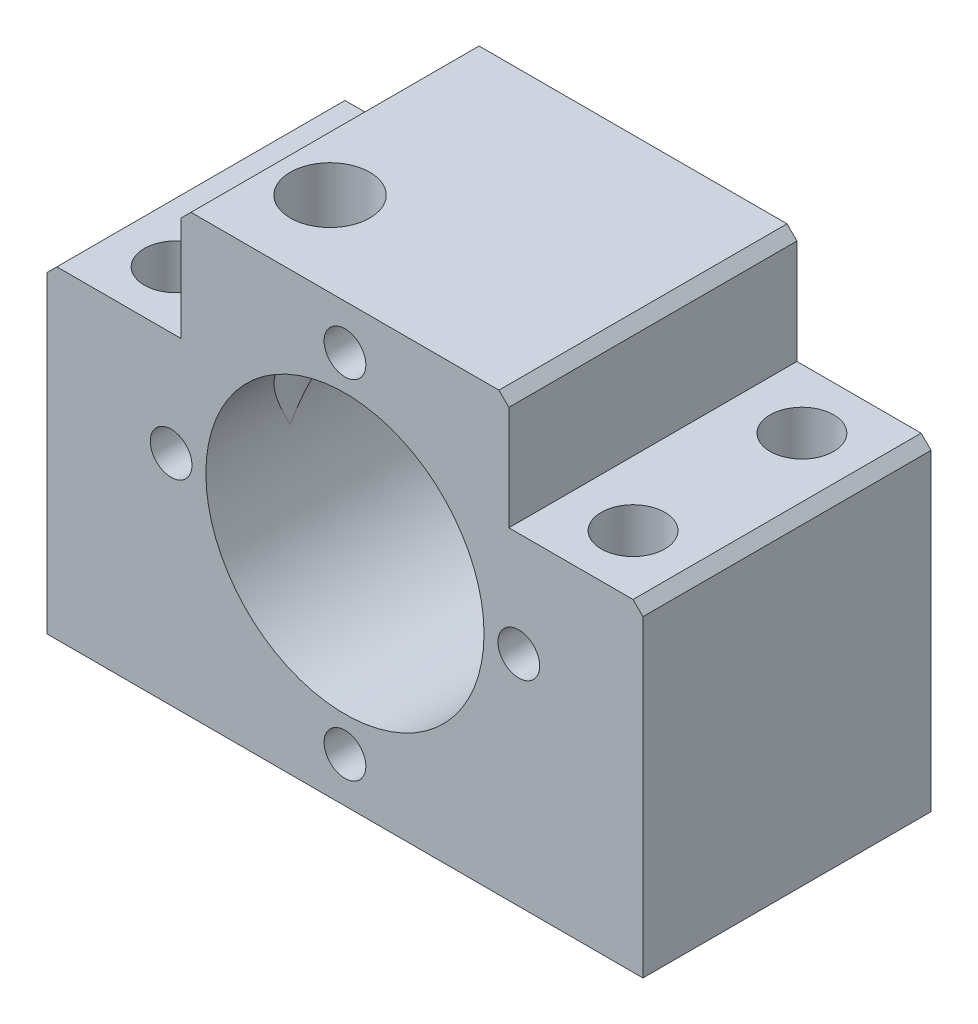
SolidWorks part; units mm, degrees
ref_plane "Plan1" through (0, 0, 0) normal (0, 0, 1) x (1, 0, 0)
ref_plane "Plan2" through (0, 0, 0) normal (0, 1, 0) x (1, 0, 0)
ref_plane "Plan3" through (0, 0, 0) normal (1, 0, 0) x (0, 0, -1)
sketch "Esquisse1" plane through (0, 0, 0) normal (0, 0, 1) x (1, 0, 0)
  line L0 (0, 36.7877) -> (0, -43.9143) construction
  line L1 (-16.5, 22) -> (16.5, 22)
  line L2 (-30, 10.5) -> (-30, -22)
  line L3 (-30, -22) -> (30, -22)
  line L4 (30, 10.5) -> (30, -22)
  line L5 (0, -50) -> (0, 50) construction
  line L6 (30, 10.5) -> (16.5, 10.5)
  line L7 (50, 0) -> (-50, 0) construction
  line L8 (16.5, 10.5) -> (16.5, 22)
  line L9 (-16.5, 10.5) -> (-16.5, 22)
  line L10 (-30, 10.5) -> (-16.5, 10.5)
  line L12 (-55.0838, 0) -> (73.4887, 0) construction
  circle A0 centre (0, 0) radius 12.5
  dimension "D1" = 25
  dimension "D4" = 33
  dimension "D2" = 22
  dimension "D3" = 22
  dimension "D5" = 32.5
  dimension "D6" = 60
extrude "Boss.-Extru.1" add sketch "Esquisse1" along normal blind 29
hole_wizard "Chambrage pour vis à tête hexagonale M61" positions "Esquisse5" profile "Esquisse6" counterbore size "M6" standard "ISO"
sketch "Esquisse5" plane through (0, 22, 0) normal (0, 1, 0) x (1, 0, 0)
  line L0 (0, 12.5688) -> (0, -56.0157) construction
  line L2 (0, -50) -> (0, 50) construction
  line L3 (-50, 0) -> (50, 0) construction
  line L4 (16.5, -29) -> (-16.5, -29) construction
  point P0 (-23, -6)
  point P2 (-23, -23)
  point P13 (23, -23)
  point P14 (23, -6)
  dimension "D1" = 6
  dimension "D2" = 6
  dimension "D3" = 17
  dimension "D4" = 46
sketch "Esquisse6" plane through (-23, 22, 6) normal (1, 0, 0) x (0, 0, 1)
  line L0 (0, 0) -> (0, 44)
  line L1 (0, 44) -> (3.2, 44)
  line L3 (3.2, 44) -> (3.2, 6.4)
  line L4 (3.2, 6.4) -> (5.5, 6.4)
  line L5 (5.5, 6.4) -> (5.5, 0)
  line L7 (5.5, 0) -> (0, 0)
  line L11 (0, -6.35) -> (0, 107.95) construction
  dimension "Diamètre du perçage jusqu'au prochain" = 6.4
  dimension "Profondeur du perçage jusqu'au prochain" = 44
  dimension "Diamètre du chambrage" = 11
  dimension "Profondeur du chambrage" = 6.4
sketch "Esquisse7" plane through (0, 0, 0) normal (0, 0, -1) x (-1, 0, 0)
  circle A0 centre (0, 0) radius 14
  dimension "D1" = 28
extrude "Enlèv. mat.-Extru.2" cut sketch "Esquisse7" against normal through all from offset 3
chamfer "Chanfrein2" distance 1 angle 45 4 edges at (30, 10.5, 14.5) (16.5, 22, 14.5) (-16.5, 22, 14.5) (-30, 10.5, 14.5)
hole_wizard "Diamètre du perçage Ø4.2 (4.2)1" positions "Esquisse8" profile "Esquisse9" hole size "Ø4.2" standard "ISO"
sketch "Esquisse8" plane through (0, 0, 0) normal (0, 0, 1) x (1, 0, 0)
  circle A0 centre (0, 0) radius 17.5
  point P3 (-17.5, 0)
  point P4 (17.5, 0)
  point P241 (0, -17.5)
  point P242 (0, 17.5)
  dimension "D1" = 35
sketch "Esquisse9" plane through (0, 17.5, 0) normal (1, 0, 0) x (0, 1, 0)
  line L0 (0, 0) -> (0, 29)
  line L1 (0, 29) -> (2.1, 29)
  line L2 (2.1, 29) -> (2.1, 0)
  line L5 (2.1, 0) -> (0, 0)
  line L11 (0, -6.35) -> (0, 107.95) construction
  dimension "Diamètre du perçage jusqu'au prochain" = 4.2
  dimension "Profondeur du perçage jusqu'au prochain" = 29
hole_wizard "Diamètre du perçage Ø8.0 (8)1" positions "Esquisse10" profile "Esquisse11" hole size "Ø8.0" standard "ISO"
sketch "Esquisse10" plane through (0, 22, 0) normal (0, 1, 0) x (1, 0, 0)
  line L0 (0, -50) -> (0, 50) construction
  line L1 (15.5, -29) -> (-15.5, -29) construction
  point P0 (-10, -20.5)
  dimension "D1" = 10
  dimension "D2" = 8.5
sketch "Esquisse11" plane through (-10, 22, 20.5) normal (1, 0, 0) x (0, 0, 1)
  line L0 (0, 0) -> (0, 24.4034)
  line L1 (0, 24.4034) -> (4, 22)
  line L2 (4, 22) -> (4, 0)
  line L5 (4, 0) -> (0, 0)
  line L10 (0, 24.4034) -> (-4, 22) construction
  line L11 (0, -6.35) -> (0, 107.95) construction
  dimension "Diamètre du perçage" = 8
  dimension "Profondeur du perçage" = 22
  dimension "Angle de pointe" = 118
chamfer "Chanfrein3" distance 1 angle 45 1 edges at (12.5, 0, 0)
